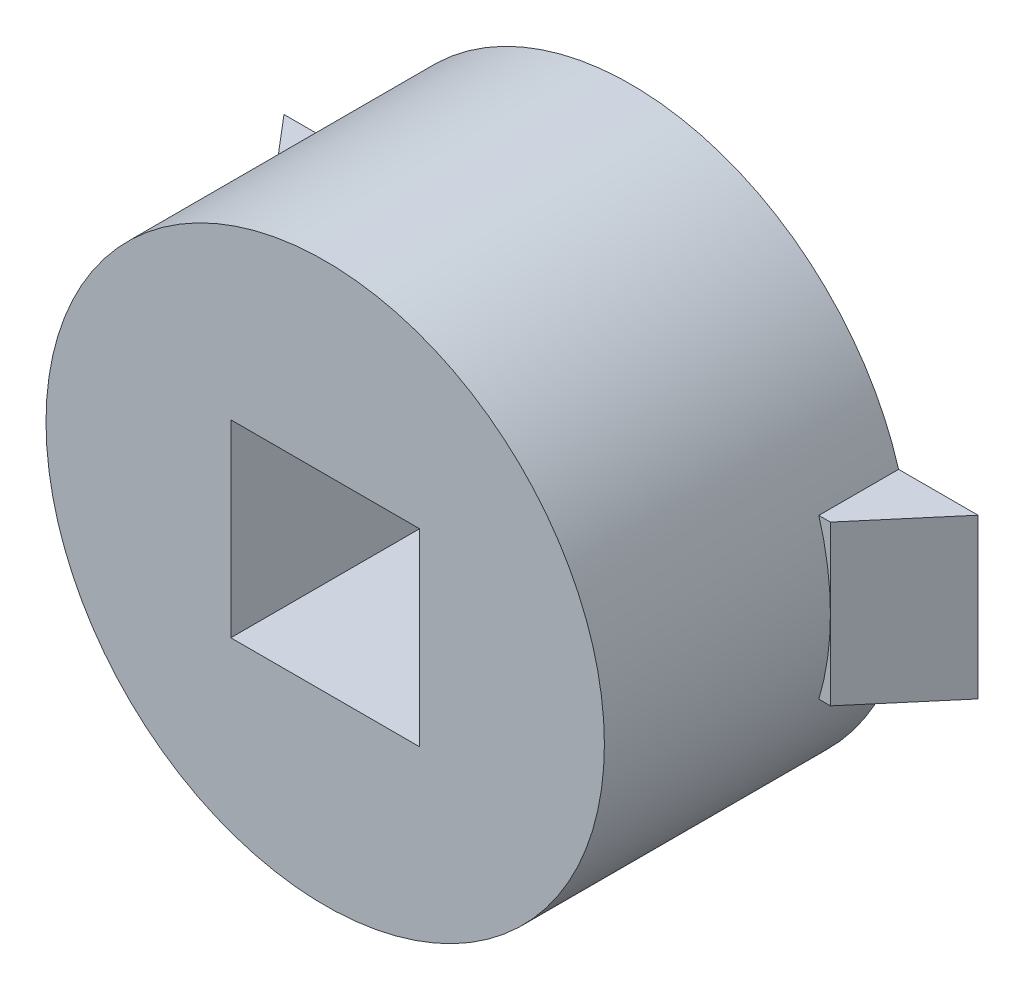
SolidWorks part; units mm, degrees
ref_plane "Front Plane" through (0, 0, 0) normal (0, 0, 1) x (1, 0, 0)
ref_plane "Top Plane" through (0, 0, 0) normal (0, 1, 0) x (1, 0, 0)
ref_plane "Right Plane" through (0, 0, 0) normal (1, 0, 0) x (0, 0, -1)
sketch "Sketch1" plane through (0, 0, 0) normal (0, 0, 1) x (1, 0, 0)
  circle A0 centre (0, 0) radius 21
  dimension "D1" = 42
extrude "Boss-Extrude1" add sketch "Sketch1" along normal blind 23
sketch "Sketch2" plane through (0, 0, 23) normal (0, 0, 1) x (1, 0, 0)
  line L1 (-7.1, -7.1) -> (7.1, -7.1)
  line L2 (-7.1, -7.1) -> (-7.1, 7.1)
  line L3 (-7.1, 7.1) -> (7.1, 7.1)
  line L4 (7.1, -7.1) -> (7.1, 7.1)
  line L5 (-7.1, -7.1) -> (7.1, 7.1) construction
  line L6 (-7.1, 7.1) -> (7.1, -7.1) construction
  point P0 (0, 0)
  dimension "D1" = 14.2
  dimension "D2" = 14.2
extrude "Cut-Extrude1" cut sketch "Sketch2" against normal blind 22
sketch "Sketch3" plane through (0, 0, 1) normal (0, 0, 1) x (1, 0, 0)
  circle A0 centre (0, 0) radius 6.5
  dimension "D1" = 13
extrude "Cut-Extrude2" cut sketch "Sketch3" against normal blind 22
sketch "Sketch6" plane through (0, 0, 0) normal (0, 0, -1) x (-1, 0, 0)
  line L0 (0, 0) -> (0, -17.1396) construction
  line L1 (-15.9001, -5.9855) -> (-26.0999, -5.9855)
  line L2 (-15.9001, -5.9855) -> (-15.9001, 5.9855)
  line L3 (-15.9001, 5.9855) -> (-26.0999, 5.9855)
  line L4 (-26.0999, -5.9855) -> (-26.0999, 5.9855)
  line L5 (-15.9001, -5.9855) -> (-26.0999, 5.9855) construction
  line L6 (-15.9001, 5.9855) -> (-26.0999, -5.9855) construction
  line L7 (15.9001, 5.9855) -> (26.0999, -5.9855) construction
  line L8 (15.9001, -5.9855) -> (26.0999, 5.9855) construction
  line L9 (26.0999, -5.9855) -> (26.0999, 5.9855)
  line L10 (15.9001, 5.9855) -> (26.0999, 5.9855)
  line L11 (15.9001, -5.9855) -> (15.9001, 5.9855)
  line L12 (15.9001, -5.9855) -> (26.0999, -5.9855)
  circle A0 centre (0, 0) radius 21 construction
  point P0 (-21, 0)
  point P13 (21, 0)
extrude "Boss-Extrude2" add sketch "Sketch6" against normal blind 6
sketch "Sketch7" plane through (0, -5.9855, 0) normal (0, -1, 0) x (1, 0, 0)
  line L0 (-26.0999, 0) -> (-21, 6)
  line L1 (-21, 6) -> (-26.0999, 6)
  line L2 (-26.0999, 6) -> (-26.0999, 0)
  line L3 (26.0999, 0) -> (21, 6)
  line L4 (21, 6) -> (26.0999, 6)
  line L5 (26.0999, 6) -> (26.0999, 0)
extrude "Cut-Extrude3" cut sketch "Sketch7" against normal blind 14
